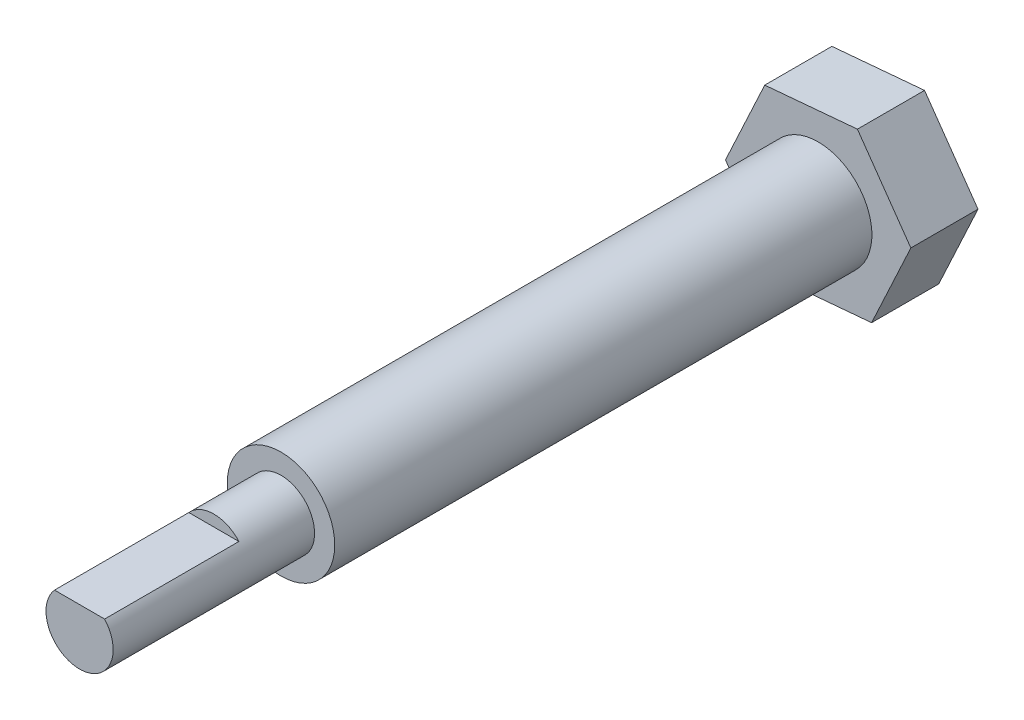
SolidWorks part; units mm, degrees
ref_plane "Front Plane" through (0, 0, 0) normal (0, 0, 1) x (1, 0, 0)
ref_plane "Top Plane" through (0, 0, 0) normal (0, 1, 0) x (1, 0, 0)
ref_plane "Right Plane" through (0, 0, 0) normal (1, 0, 0) x (0, 0, -1)
sketch "Sketch1" plane through (0, 0, 0) normal (0, 0, 1) x (1, 0, 0)
  circle A0 centre (0, 0) radius 19.05
extrude "Boss-Extrude1" add sketch "Sketch1" along normal blind 50.8
sketch "Sketch2" plane through (0, 0, 50.8) normal (0, 0, 1) x (1, 0, 0)
  circle A0 centre (0, 0) radius 3.175
extrude "Boss-Extrude2" add sketch "Sketch2" along normal blind 19.05
sketch "Sketch3" plane through (0, 0, 69.85) normal (0, 0, 1) x (1, 0, 0)
  line L1 (-3.6318, 3.5591) -> (3.9436, 3.5591)
  line L2 (-3.6318, 3.5591) -> (-3.6318, 2.1124)
  line L3 (-3.6318, 2.1124) -> (3.9436, 2.1124)
  line L4 (3.9436, 3.5591) -> (3.9436, 2.1124)
extrude "Cut-Extrude1" cut sketch "Sketch3" against normal blind 12.7
sketch "Sketch4" plane through (0, 0, 0) normal (0, 0, -1) x (-1, 0, 0)
  circle A0 centre (0, 0) radius 19.8244
extrude "Cut-Extrude2" cut sketch "Sketch4" against normal blind 50.8
sketch "Sketch5" plane through (0, 0, 0) normal (0, 0, 1) x (1, 0, 0)
  circle A0 centre (0, 0) radius 5.08
extrude "Boss-Extrude3" add sketch "Sketch5" along normal blind 50.8
sketch "Sketch6" plane through (0, 0, 0) normal (0, 0, -1) x (-1, 0, 0)
  line L1 (3.7111, -7.9779) -> (8.7646, -0.7751)
  line L2 (8.7646, -0.7751) -> (5.0536, 7.2028)
  line L3 (5.0536, 7.2028) -> (-3.7111, 7.9779)
  line L4 (-3.7111, 7.9779) -> (-8.7646, 0.7751)
  line L5 (-8.7646, 0.7751) -> (-5.0536, -7.2028)
  line L6 (-5.0536, -7.2028) -> (3.7111, -7.9779)
  circle A0 centre (0, 0) radius 7.62 construction
extrude "Boss-Extrude4" add sketch "Sketch6" along normal blind 6.35
